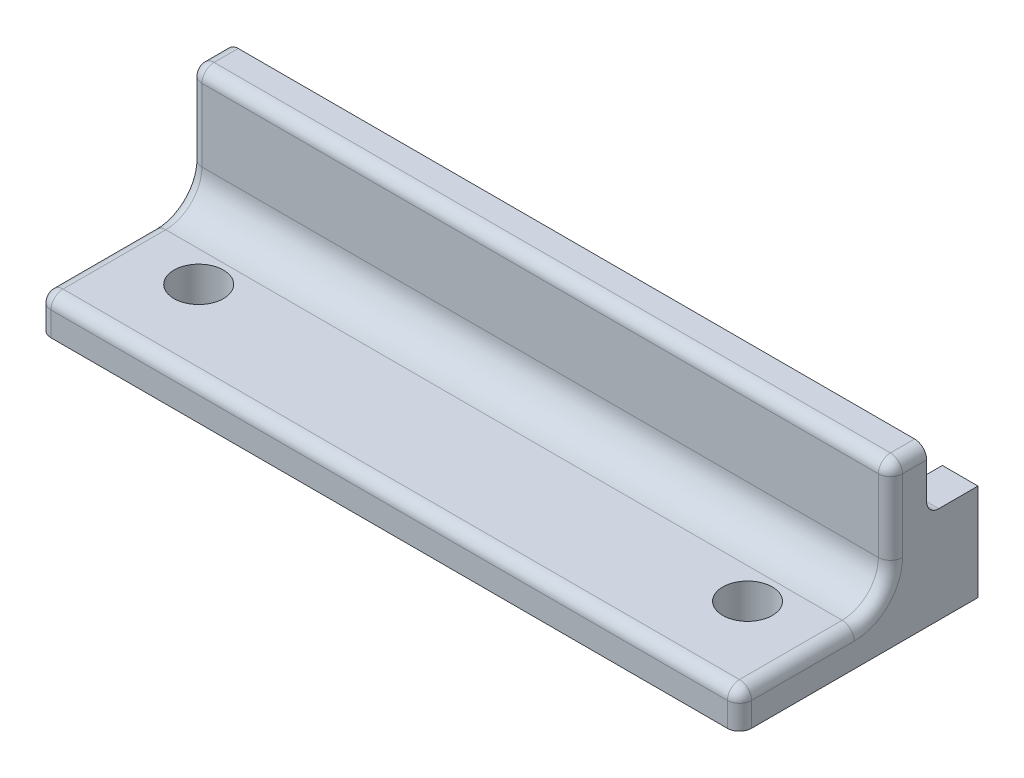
SolidWorks part; units mm, degrees
ref_plane "Plan de face" through (0, 0, 0) normal (0, 0, 1) x (1, 0, 0)
ref_plane "Plan de dessus" through (0, 0, 0) normal (0, 1, 0) x (1, 0, 0)
ref_plane "Plan de droite" through (0, 0, 0) normal (1, 0, 0) x (0, 0, -1)
sketch "Esquisse1" plane through (0, 0, 0) normal (0, 0, 1) x (1, 0, 0)
  line L1 (46.4004, 6.6593) -> (-11.5996, 6.6593)
  line L2 (46.4004, 6.6593) -> (46.4004, -3.3407)
  line L3 (46.4004, -3.3407) -> (-11.5996, -3.3407)
  line L4 (-11.5996, 6.6593) -> (-11.5996, -3.3407)
  dimension "D1" = 58
  dimension "D2" = 10
extrude "Boss.-Extru.1" add sketch "Esquisse1" along normal blind 3
ref_plane "Plan1" through (46.4004, -3.3407, 0) normal (1, 0, 0) x (0, 0, -1)
ref_plane "Plan2" through (-11.5996, -3.3407, 3) normal (1, 0, 0) x (0, 0, -1)
sketch "Esquisse4" plane through (0, -3.3407, 0) normal (0, -1, 0) x (1, 0, 0)
  line L1 (46.4004, 0) -> (-11.5996, 0)
  line L2 (46.4004, 0) -> (46.4004, 15.5)
  line L3 (46.4004, 15.5) -> (-11.5996, 15.5)
  line L4 (-11.5996, 0) -> (-11.5996, 15.5)
  circle A0 centre (40.1204, 8.549) radius 2.05
  circle A1 centre (-5.3196, 8.549) radius 2.05
  dimension "D3" = 8.549
  dimension "D7" = 4.1
  dimension "D8" = 4.1
  dimension "D1" = 58
  dimension "D2" = 15.5
  dimension "D4" = 6.28
  dimension "D5" = 8.549
  dimension "D6" = 6.28
extrude "Boss.-Extru.2" add sketch "Esquisse4" along normal blind 3
fillet "Congé1" [suppressed] radius 3
fillet "Congé2" [suppressed] radius 1
fillet "Congé3" radius 3 1 edges at (17.4004, -3.3407, 3)
fillet "Congé4" radius 1 1 edges at (17.4004, -3.3407, 15.5)
fillet "Congé5" radius 1 1 edges at (17.4004, 6.6593, 3)
fillet "Congé6" radius 1 7 edges at (-11.5996, -5.3407, 15.5) (-11.5996, -3.6336, 15.2071) (-11.5996, 6.6593, 1) (-11.5996, 6.3664, 2.7071) (-11.5996, 2.6593, 3) (-11.5996, -2.462, 3.8787) (-11.5996, -3.3407, 10.25)
fillet "Congé7" radius 1 7 edges at (46.4004, 6.6593, 1) (46.4004, 6.3664, 2.7071) (46.4004, 2.6593, 3) (46.4004, -2.462, 3.8787) (46.4004, -5.3407, 15.5) (46.4004, -3.6336, 15.2071) (46.4004, -3.3407, 10.25)
sketch "Esquisse6" plane through (0, 0, 0) normal (0, 0, -1) x (-1, 0, 0)
  line L0 (-46.4004, 5.6593) -> (-46.4004, -6.3407) construction
  line L1 (11.5996, 5.6593) -> (11.5996, -6.3407) construction
  line L2 (11.5996, -6.3407) -> (-46.4004, -6.3407) construction
  circle A0 centre (-38.5004, 1.6593) radius 1.2
  circle A1 centre (3.6996, 1.6593) radius 1.2
  dimension "D1" = 2.4
  dimension "D2" = 2.4
  dimension "D3" = 7.9
  dimension "D4" = 7.9
  dimension "D5" = 8
  dimension "D6" = 8
extrude "Boss.-Extru.3" add sketch "Esquisse6" along normal blind 3
ref_plane "Plan3" through (46.4004, -6.3407, 0) normal (0, -1, 0) x (-1, 0, 0)
sketch "Esquisse7" plane through (46.4004, -6.3407, 0) normal (0, -1, 0) x (1, 0, 0)
  line L0 (-58, 0) -> (0, 0) construction
  line L10 (-55.05, 0) -> (-58, 0)
  line L11 (-55.05, 0) -> (-55.05, -4.25)
  line L12 (-55.05, -4.25) -> (-58, -4.25)
  line L13 (-58, 0) -> (-58, -4.25)
  line L15 (-2.95, 0) -> (0, 0)
  line L16 (-2.95, 0) -> (-2.95, -4.25)
  line L17 (-2.95, -4.25) -> (0, -4.25)
  line L18 (0, 0) -> (0, -4.25)
  dimension "D1" = 52.1
  dimension "D2" = 2.95
  dimension "D3" = 4.25
  dimension "D4" = 2.95
  dimension "D5" = 4.25
extrude "Boss.-Extru.4" add sketch "Esquisse7" against normal blind 8
fillet "Congé8" radius 1 1 edges at (-10.1246, 1.6593, 0)
fillet "Congé9" radius 1 1 edges at (44.9254, 1.6593, 0)
